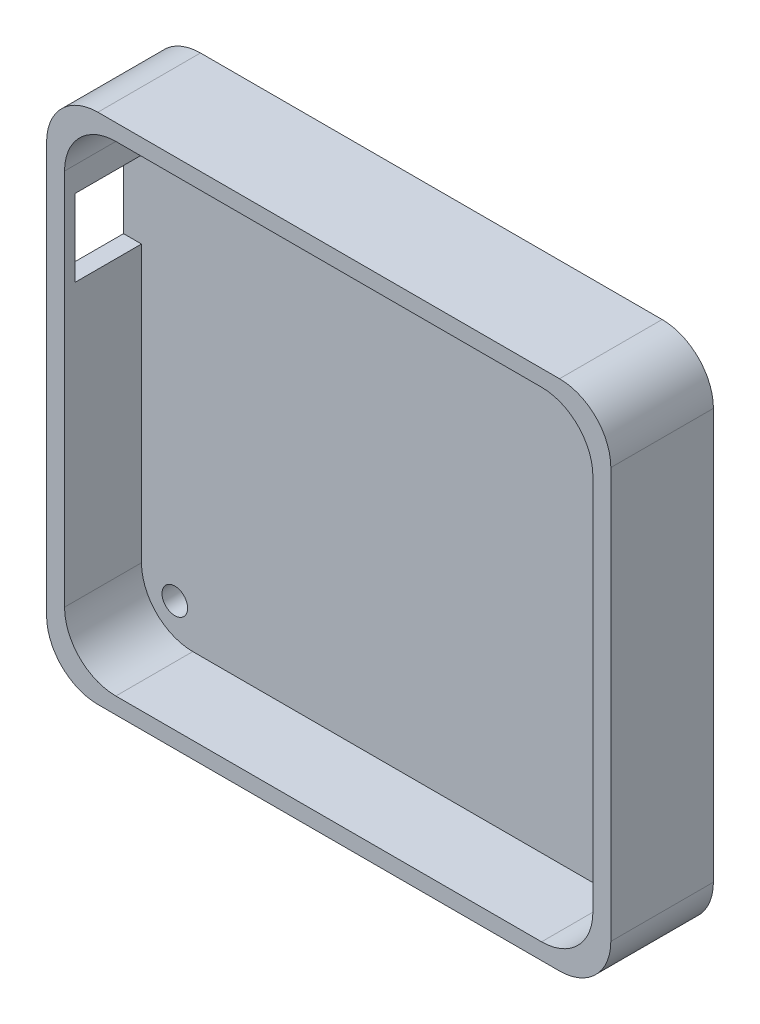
SolidWorks part; units mm, degrees
ref_plane "Front Plane" through (0, 0, 0) normal (0, 0, 1) x (1, 0, 0)
ref_plane "Top Plane" through (0, 0, 0) normal (0, 1, 0) x (1, 0, 0)
ref_plane "Right Plane" through (0, 0, 0) normal (1, 0, 0) x (0, 0, -1)
sketch "Sketch1" plane through (0, 0, 0) normal (0, 0, 1) x (1, 0, 0)
  line L0 (-55, 0) -> (-38, 0) construction
  line L1 (45, -50) -> (-45, -50)
  line L2 (55, -40) -> (55, 40)
  line L3 (45, 50) -> (-45, 50)
  line L4 (-55, -40) -> (-55, 40)
  line L5 (55, -50) -> (36.2805, -32.9823) construction
  line L6 (55, 50) -> (-36.3298, -33.0271) construction
  line L7 (0, 50) -> (0, -50) construction
  line L45 (36.2805, -32.9823) -> (-55, 50) construction
  line L46 (-38, 0) -> (55, 0) construction
  line L47 (-36.3298, -33.0271) -> (-55, -50) construction
  arc A0 (45, -50) -> (55, -40) centre (45, -40) ccw
  arc A1 (-45, -50) -> (-55, -40) centre (-45, -40) cw
  arc A2 (55, 40) -> (45, 50) centre (45, 40) ccw
  arc A3 (-45, 50) -> (-55, 40) centre (-45, 40) ccw
  circle A4 centre (-45, 40) radius 2.5
  circle A5 centre (-45, -40) radius 2.5
  circle A6 centre (45, -40) radius 2.5
  circle A7 centre (45, 40) radius 2.5
  point P0 (0, 0)
  dimension "D3" = 10
  dimension "D4" = 5
  dimension "D1" = 100
  dimension "D2" = 110
extrude "Boss-Extrude1" add sketch "Sketch1" along normal blind 5
sketch "Sketch2" plane through (0, 0, 5) normal (0, 0, 1) x (1, 0, 0)
  line L0 (-48.4302, 44.0274) -> (-55, 50) construction
  line L1 (45, -50) -> (-45, -50)
  line L2 (55, -40) -> (55, 40)
  line L3 (45, 50) -> (-45, 50)
  line L4 (-55, -40) -> (-55, 40)
  line L5 (55, -50) -> (48.4302, -44.0274) construction
  line L6 (55, 50) -> (48.4302, 44.0274) construction
  line L7 (41.5, -46.8182) -> (-41.5, -46.8182)
  line L8 (51.5, -36.8182) -> (51.5, 36.8182)
  line L9 (41.5, 46.8182) -> (-41.5, 46.8182)
  line L10 (-51.5, -36.8182) -> (-51.5, 36.8182)
  line L11 (51.5, -46.8182) -> (48.4302, -44.0274) construction
  line L12 (51.5, 46.8182) -> (48.4302, 44.0274) construction
  line L13 (-48.4302, 44.0274) -> (-51.5, 46.8182) construction
  line L14 (-48.4302, -44.0274) -> (-51.5, -46.8182) construction
  line L15 (-48.4302, -44.0274) -> (-55, -50) construction
  arc A0 (45, -50) -> (55, -40) centre (45, -40) ccw
  arc A1 (55, 40) -> (45, 50) centre (45, 40) ccw
  arc A2 (-45, -50) -> (-55, -40) centre (-45, -40) cw
  arc A3 (-45, 50) -> (-55, 40) centre (-45, 40) ccw
  arc A4 (51.5, 36.8182) -> (41.5, 46.8182) centre (41.5, 36.8182) ccw
  arc A5 (41.5, -46.8182) -> (51.5, -36.8182) centre (41.5, -36.8182) ccw
  arc A6 (-41.5, -46.8182) -> (-51.5, -36.8182) centre (-41.5, -36.8182) cw
  arc A7 (-41.5, 46.8182) -> (-51.5, 36.8182) centre (-41.5, 36.8182) ccw
  point P0 (0, 0)
  point P18 (0, 0)
  dimension "D3" = 10
  dimension "D5" = 10
  dimension "D1" = 110
  dimension "D2" = 100
  dimension "D4" = 3.5
extrude "Boss-Extrude2" add sketch "Sketch2" along normal blind 15 contours A3 L3 A1 L2 A0 L1 A2 L4 | A7 L9 A4 L8 A5 L7 A6 L10
sketch "Sketch4" plane through (-55, 0, 0) normal (-1, 0, 0) x (0, 0, 1)
  line L0 (20, 50) -> (0, 50) construction
  line L1 (5, 32) -> (18, 32)
  line L2 (5, 32) -> (5, 17)
  line L3 (5, 17) -> (18, 17)
  line L4 (18, 32) -> (18, 17)
  line L5 (0, 40) -> (0, -40) construction
  line L6 (20, -40) -> (20, 40) construction
  dimension "D1" = 18
  dimension "D2" = 15
  dimension "D3" = 5
  dimension "D4" = 2
extrude "Cut-Extrude1" cut sketch "Sketch4" against normal blind 6
